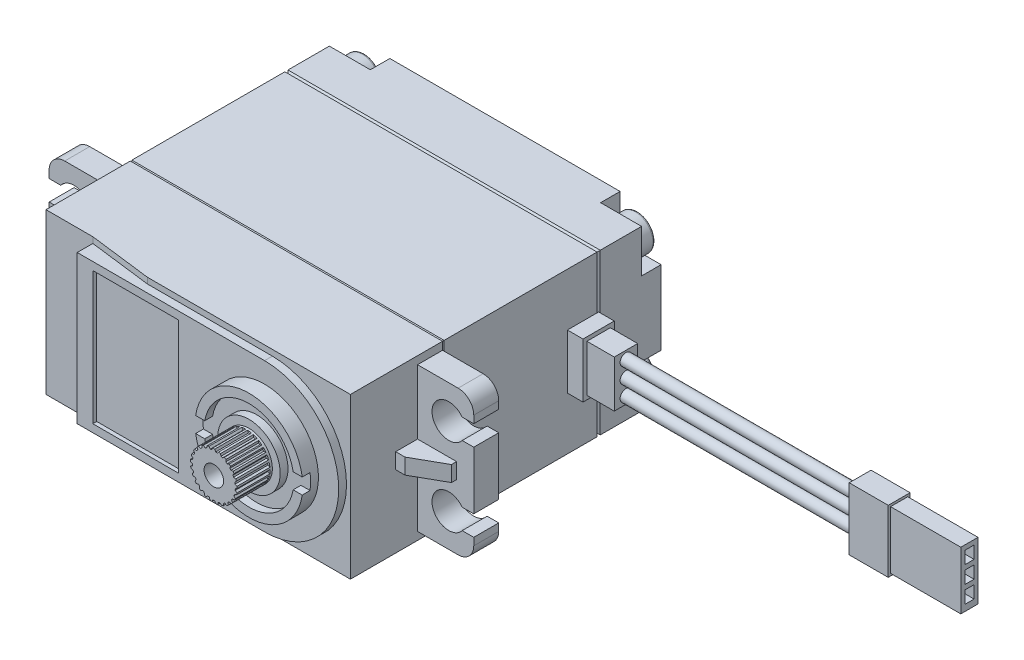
SolidWorks part; units mm, degrees
ref_plane "前视基准面" through (0, 0, 0) normal (0, 0, 1) x (1, 0, 0)
ref_plane "上视基准面" through (0, 0, 0) normal (0, 1, 0) x (1, 0, 0)
ref_plane "右视基准面" through (0, 0, 0) normal (1, 0, 0) x (0, 0, -1)
sketch "草图1" plane through (0, 0, 0) normal (0, 0, 1) x (1, 0, 0)
  line L1 (-20, 10.25) -> (20, 10.25)
  line L2 (-20, 10.25) -> (-20, -10.25)
  line L3 (-20, -10.25) -> (20, -10.25)
  line L4 (20, 10.25) -> (20, -10.25)
  dimension "D1" = 10.25
  dimension "D2" = 20.5
  dimension "D3" = 20
  dimension "D4" = 40
extrude "凸台-拉伸1" add sketch "草图1" along normal blind 8
chamfer "倒角1" distance 0.2 angle 45 4 edges at (0, 10.25, 8) (20, 0, 8) (0, -10.25, 8) (-20, 0, 8)
sketch "草图2" plane through (0, 0, 8) normal (0, 0, 1) x (1, 0, 0)
  line L0 (20, 10.25) -> (20, -10.25) construction
  line L1 (20, -10.25) -> (-20, -10.25) construction
  line L2 (-20, -10.25) -> (-20, 10.25) construction
  line L3 (-20, 10.25) -> (20, 10.25) construction
  line L4 (20, 10.25) -> (20, -10.25)
  line L5 (20, -10.25) -> (-20, -10.25)
  line L6 (-20, -10.25) -> (-20, 10.25)
  line L7 (-20, 10.25) -> (20, 10.25)
extrude "凸台-拉伸2" add sketch "草图2" along normal blind 20
chamfer "倒角4" distance 0.2 angle 45 4 edges at (-20, 0, 8) (0, 10.25, 8) (20, 0, 8) (0, -10.25, 8)
chamfer "倒角5" distance 0.2 angle 45 4 edges at (20, 0, 28) (0, -10.25, 28) (-20, 0, 28) (0, 10.25, 28)
sketch "草图3" plane through (0, 0, 28) normal (0, 0, 1) x (1, 0, 0)
  line L0 (20, 10.25) -> (20, -10.25) construction
  line L1 (20, -10.25) -> (-20, -10.25) construction
  line L2 (-20, -10.25) -> (-20, 10.25) construction
  line L3 (-20, 10.25) -> (20, 10.25) construction
  line L4 (20, 10.25) -> (20, -10.25)
  line L5 (20, -10.25) -> (-20, -10.25)
  line L6 (-20, -10.25) -> (-20, 10.25)
  line L7 (-20, 10.25) -> (20, 10.25)
extrude "凸台-拉伸3" add sketch "草图3" along normal blind 12.8
sketch "草图4" plane through (0, 0, 40.8) normal (0, 0, 1) x (1, 0, 0)
  line L0 (20, -10.25) -> (20, 10.25) construction
  circle A0 centre (10, 0) radius 6.9
  dimension "D1" = 10
  dimension "D2" = 13.8
extrude "凸台-拉伸4" add sketch "草图4" along normal blind 2
sketch "草图5" plane through (0, 0, 42.8) normal (0, 0, 1) x (1, 0, 0)
  circle A0 centre (10, 0) radius 3
  dimension "D1" = 6
extrude "凸台-拉伸5" add sketch "草图5" along normal blind 4.5
sketch "草图6" plane through (0, 0, 42.8) normal (0, 0, 1) x (1, 0, 0)
  circle A0 centre (10, 0) radius 4
  circle A1 centre (10, 0) radius 5.75
  dimension "D1" = 8
  dimension "D2" = 11.5
extrude "切除-拉伸1" cut sketch "草图6" against normal blind 1
sketch "草图7" plane through (0, 0, 41.8) normal (0, 0, 1) x (1, 0, 0)
  line L1 (3.1728, -1) -> (4.3376, -1)
  line L2 (3.1728, 1) -> (4.3376, 1)
  line L3 (15.6624, 1) -> (16.8272, 1)
  line L4 (15.6624, -1) -> (16.8272, -1)
  circle A0 centre (10, 0) radius 5.75 construction
  arc A1 (4.3376, 1) -> (4.3376, -1) centre (10, 0) ccw
  circle A2 centre (10, 0) radius 6.9 construction
  arc A3 (3.1728, 1) -> (3.1728, -1) centre (10, 0) ccw
  arc A4 (16.8272, -1) -> (16.8272, 1) centre (10, 0) ccw
  arc A5 (15.6624, -1) -> (15.6624, 1) centre (10, 0) ccw
  point P3 (0.7328, -1)
  point P4 (20.4054, -1)
  point P5 (0.7328, 1)
  point P6 (20.4054, 1)
extrude "切除-拉伸5" cut sketch "草图7" along normal blind 1
ref_plane "基准面1" through (0, 0, 28) normal (0, 0, 1) x (1, 0, 0)
sketch "草图8" plane through (0, 0, 28) normal (0, 0, 1) x (1, 0, 0)
  line L4 (-20, 10.25) -> (-20, -10.25) construction
  line L5 (-27.2, 9.25) -> (-27.2, 6.3)
  line L6 (20, -9.25) -> (27.2, -9.25)
  line L7 (-20, 9.25) -> (-20, -9.25)
  line L8 (-20, -9.25) -> (-27.2, -9.25)
  line L9 (-20, 9.25) -> (-27.2, 9.25)
  line L10 (27.2, -6.3) -> (27.2, -9.25)
  line L12 (25.7125, -6.3) -> (27.2, -6.3)
  line L13 (25.7125, -3.7) -> (27.2, -3.7)
  line L14 (-25.7125, 6.3) -> (-27.2, 6.3)
  line L15 (-25.7125, 3.7) -> (-27.2, 3.7)
  line L16 (-27.2, 3.7) -> (-27.2, -3.7)
  line L17 (27.2, 3.7) -> (27.2, -3.7)
  line L18 (-25.7125, -3.7) -> (-27.2, -3.7)
  line L19 (25.7125, 3.7) -> (27.2, 3.7)
  line L20 (-25.7125, -6.3) -> (-27.2, -6.3)
  line L21 (-27.2, -6.3) -> (-27.2, -9.25)
  line L22 (25.7125, 6.3) -> (27.2, 6.3)
  line L23 (27.2, 9.25) -> (27.2, 6.3)
  line L24 (20, 9.25) -> (20, -9.25)
  line L25 (20, 9.25) -> (27.2, 9.25)
  arc A0 (-25.7125, 3.7) -> (-25.7125, 6.3) centre (-24, 5) ccw
  arc A1 (-25.7125, -3.7) -> (-25.7125, -6.3) centre (-24, -5) cw
  arc A2 (25.7125, -3.7) -> (25.7125, -6.3) centre (24, -5) ccw
  arc A3 (25.7125, 3.7) -> (25.7125, 6.3) centre (24, 5) cw
  point P11 (-27.2, 10.25)
  point P12 (-27.2, -10.25)
  point P19 (-19.0859, 9.25)
  point P20 (-30.2671, 9.25)
  point P29 (-24, 6.3)
  point P31 (-29.7758, 6.3)
  point P32 (-24, 3.7)
  point P33 (-29.7758, 3.7)
  dimension "D5" = 4.3
extrude "凸台-拉伸6" add sketch "草图8" along normal blind 3.2
sketch "草图9" plane through (0, 0, 31.2) normal (0, 0, 1) x (1, 0, 0)
  line L5 (-25, -1) -> (-20, -1)
  line L6 (-25, 1) -> (-20, 1)
  line L7 (-20, -9.25) -> (-20, 9.25) construction
  line L8 (-20, -1) -> (-20, 1)
  line L10 (-25, -1) -> (-25, 1)
  line L12 (25, -1) -> (25, 1)
  line L13 (25, -1) -> (20, -1)
  line L14 (20, -1) -> (20, 1)
  line L15 (25, 1) -> (20, 1)
  line L18 (-20, -9.25) -> (-20, 9.25) construction
  line L19 (-25, -9.25) -> (-25, 9.25) construction
  point P0 (-27.2, 0)
  point P1 (-27.2, -1)
  point P2 (0.4483, -1)
  point P3 (0.4483, 0)
  point P6 (-27.2, 1)
  point P7 (0.4483, 1)
extrude "凸台-拉伸7" add sketch "草图9" along normal blind 2.8
sketch "草图10" plane through (0, -1, 0) normal (0, -1, 0) x (1, 0, 0)
  line L0 (-25, 31.8565) -> (-21.193, 34)
  line L1 (-25, 34) -> (-25, 31.2) construction
  line L2 (-25, 34) -> (-20, 34) construction
  line L3 (-21.193, 34) -> (-25, 34)
  line L4 (-25, 34) -> (-25, 31.8565)
  line L7 (25, 34) -> (25, 31.8565)
  line L8 (25, 31.8565) -> (21.193, 34)
  line L9 (21.193, 34) -> (25, 34)
extrude "切除-拉伸6" cut sketch "草图10" against normal blind 2.8
sketch "草图11" plane through (0, 0, 47.3) normal (0, 0, 1) x (1, 0, 0)
  circle A0 centre (10, 0) radius 1.25
  dimension "D1" = 2.5
extrude "切除-拉伸7" cut sketch "草图11" against normal blind 6
sketch "草图12" plane through (0, 0, 47.3) normal (0, 0, 1) x (1, 0, 0)
  line L1 (9.76, 2.7395) -> (9.88, 2.9976)
  line L2 (10.24, 2.7395) -> (10.12, 2.9976)
  line L3 (10.9137, 2.5938) -> (10.8617, 2.8736)
  line L4 (10.4488, 2.7131) -> (10.6292, 2.9333)
  line L5 (11.5301, 2.285) -> (11.5493, 2.569)
  line L6 (11.1095, 2.5163) -> (11.3389, 2.6846)
  line L7 (12.0503, 1.8327) -> (12.1395, 2.103)
  line L8 (11.7004, 2.1613) -> (11.9645, 2.2673)
  line L9 (12.4416, 1.2653) -> (12.5953, 1.5049)
  line L10 (12.1844, 1.6705) -> (12.4667, 1.7075)
  line L11 (12.6796, 0.6183) -> (12.888, 0.8122)
  line L12 (12.5313, 1.0748) -> (12.8138, 1.0404)
  line L13 (12.7492, -0.0675) -> (12.9992, 0.0685)
  line L14 (12.719, 0.4115) -> (12.9841, 0.308)
  line L15 (12.646, -0.7491) -> (12.922, -0.6796)
  line L16 (12.736, -0.2776) -> (12.967, -0.4438)
  line L17 (12.3766, -1.3836) -> (12.6612, -1.3849)
  line L18 (12.581, -0.9493) -> (12.7634, -1.1677)
  line L19 (11.9578, -1.9312) -> (12.2332, -2.0032)
  line L20 (12.2638, -1.5613) -> (12.3862, -1.8183)
  line L21 (11.4161, -2.3574) -> (11.6649, -2.4956)
  line L22 (11.8044, -2.0752) -> (11.859, -2.3546)
  line L23 (10.7853, -2.6355) -> (10.9919, -2.8313)
  line L24 (11.2316, -2.4588) -> (11.2151, -2.7429)
  line L25 (10.1052, -2.748) -> (10.2566, -2.989)
  line L26 (10.5815, -2.6878) -> (10.4948, -2.9589)
  line L27 (9.4185, -2.6878) -> (9.5052, -2.9589)
  line L28 (9.8948, -2.748) -> (9.7434, -2.989)
  line L29 (8.7684, -2.4588) -> (8.7849, -2.7429)
  line L30 (9.2147, -2.6355) -> (9.0081, -2.8313)
  line L31 (8.1956, -2.0752) -> (8.141, -2.3546)
  line L32 (8.5839, -2.3574) -> (8.3351, -2.4956)
  line L33 (7.7362, -1.5613) -> (7.6138, -1.8183)
  line L34 (8.0422, -1.9312) -> (7.7668, -2.0032)
  line L35 (7.419, -0.9493) -> (7.2366, -1.1677)
  line L36 (7.6234, -1.3836) -> (7.3388, -1.3849)
  line L37 (7.264, -0.2776) -> (7.033, -0.4438)
  line L38 (7.354, -0.7491) -> (7.078, -0.6796)
  line L39 (7.281, 0.4115) -> (7.0159, 0.308)
  line L40 (7.2508, -0.0675) -> (7.0008, 0.0685)
  line L41 (7.4687, 1.0748) -> (7.1862, 1.0404)
  line L42 (7.3204, 0.6183) -> (7.112, 0.8122)
  line L43 (7.8156, 1.6705) -> (7.5333, 1.7075)
  line L44 (7.5584, 1.2653) -> (7.4047, 1.5049)
  line L45 (8.2996, 2.1613) -> (8.0355, 2.2673)
  line L46 (7.9497, 1.8327) -> (7.8605, 2.103)
  line L47 (8.8905, 2.5163) -> (8.6611, 2.6846)
  line L48 (8.4699, 2.285) -> (8.4507, 2.569)
  line L49 (9.5512, 2.7131) -> (9.3708, 2.9333)
  line L50 (9.0863, 2.5938) -> (9.1383, 2.8736)
  arc A0 (9.76, 2.7395) -> (9.5512, 2.7131) centre (10, 0) ccw
  arc A1 (9.0863, 2.5938) -> (8.8905, 2.5163) centre (10, 0) ccw
  circle A2 centre (10, 0) radius 3 construction
  arc A3 (9.88, 2.9976) -> (9.3708, 2.9333) centre (10, 0) ccw
  arc A4 (9.1383, 2.8736) -> (8.6611, 2.6846) centre (10, 0) ccw
  arc A5 (8.4699, 2.285) -> (8.2996, 2.1613) centre (10, 0) ccw
  arc A6 (8.4507, 2.569) -> (8.0355, 2.2673) centre (10, 0) ccw
  arc A7 (7.9497, 1.8327) -> (7.8156, 1.6705) centre (10, 0) ccw
  arc A8 (7.8605, 2.103) -> (7.5333, 1.7075) centre (10, 0) ccw
  arc A9 (7.5584, 1.2653) -> (7.4687, 1.0748) centre (10, 0) ccw
  arc A10 (7.4047, 1.5049) -> (7.1862, 1.0404) centre (10, 0) ccw
  arc A11 (7.3204, 0.6183) -> (7.281, 0.4115) centre (10, 0) ccw
  arc A12 (7.112, 0.8122) -> (7.0159, 0.308) centre (10, 0) ccw
  arc A13 (7.2508, -0.0675) -> (7.264, -0.2776) centre (10, 0) ccw
  arc A14 (7.0008, 0.0685) -> (7.033, -0.4438) centre (10, 0) ccw
  arc A15 (7.354, -0.7491) -> (7.419, -0.9493) centre (10, 0) ccw
  arc A16 (7.078, -0.6796) -> (7.2366, -1.1677) centre (10, 0) ccw
  arc A17 (7.3388, -1.3849) -> (7.6138, -1.8183) centre (10, 0) ccw
  arc A18 (7.6234, -1.3836) -> (7.7362, -1.5613) centre (10, 0) ccw
  arc A19 (8.0422, -1.9312) -> (8.1956, -2.0752) centre (10, 0) ccw
  arc A20 (7.7668, -2.0032) -> (8.141, -2.3546) centre (10, 0) ccw
  arc A21 (8.5839, -2.3574) -> (8.7684, -2.4588) centre (10, 0) ccw
  arc A22 (8.3351, -2.4956) -> (8.7849, -2.7429) centre (10, 0) ccw
  arc A23 (9.2147, -2.6355) -> (9.4185, -2.6878) centre (10, 0) ccw
  arc A24 (9.0081, -2.8313) -> (9.5052, -2.9589) centre (10, 0) ccw
  arc A25 (9.8948, -2.748) -> (10.1052, -2.748) centre (10, 0) ccw
  arc A26 (9.7434, -2.989) -> (10.2566, -2.989) centre (10, 0) ccw
  arc A27 (10.5815, -2.6878) -> (10.7853, -2.6355) centre (10, 0) ccw
  arc A28 (10.4948, -2.9589) -> (10.9919, -2.8313) centre (10, 0) ccw
  arc A29 (11.2316, -2.4588) -> (11.4161, -2.3574) centre (10, 0) ccw
  arc A30 (11.2151, -2.7429) -> (11.6649, -2.4956) centre (10, 0) ccw
  arc A31 (11.8044, -2.0752) -> (11.9578, -1.9312) centre (10, 0) ccw
  arc A32 (11.859, -2.3546) -> (12.2332, -2.0032) centre (10, 0) ccw
  arc A33 (12.3862, -1.8183) -> (12.6612, -1.3849) centre (10, 0) ccw
  arc A34 (12.2638, -1.5613) -> (12.3766, -1.3836) centre (10, 0) ccw
  arc A35 (12.7634, -1.1677) -> (12.922, -0.6796) centre (10, 0) ccw
  arc A36 (12.581, -0.9493) -> (12.646, -0.7491) centre (10, 0) ccw
  arc A37 (12.967, -0.4438) -> (12.9992, 0.0685) centre (10, 0) ccw
  arc A38 (12.736, -0.2776) -> (12.7492, -0.0675) centre (10, 0) ccw
  arc A39 (12.9841, 0.308) -> (12.888, 0.8122) centre (10, 0) ccw
  arc A40 (12.719, 0.4115) -> (12.6796, 0.6183) centre (10, 0) ccw
  arc A41 (12.5313, 1.0748) -> (12.4416, 1.2653) centre (10, 0) ccw
  arc A42 (12.8138, 1.0404) -> (12.5953, 1.5049) centre (10, 0) ccw
  arc A43 (12.1844, 1.6705) -> (12.0503, 1.8327) centre (10, 0) ccw
  arc A44 (12.4667, 1.7075) -> (12.1395, 2.103) centre (10, 0) ccw
  arc A45 (11.7004, 2.1613) -> (11.5301, 2.285) centre (10, 0) ccw
  arc A46 (11.9645, 2.2673) -> (11.5493, 2.569) centre (10, 0) ccw
  arc A47 (11.1095, 2.5163) -> (10.9137, 2.5938) centre (10, 0) ccw
  arc A48 (11.3389, 2.6846) -> (10.8617, 2.8736) centre (10, 0) ccw
  arc A49 (10.4488, 2.7131) -> (10.24, 2.7395) centre (10, 0) ccw
  arc A50 (10.6292, 2.9333) -> (10.12, 2.9976) centre (10, 0) ccw
  point P111 (10, 0)
  dimension "D1" = 5.5
  dimension "D4" = 25
extrude "切除-拉伸8" cut sketch "草图12" against normal blind 4.2
sketch "草图13" plane through (0, 0, 40.8) normal (0, 0, 1) x (1, 0, 0)
  line L0 (10, 9.5) -> (-14, 9.5)
  line L1 (10, -9.5) -> (-14, -9.5)
  line L2 (20, -10.25) -> (20, 10.25) construction
  line L5 (-20, -10.25) -> (20, -10.25) construction
  line L6 (-14, 9.5) -> (-14, -9.5)
  line L7 (-20, 10.25) -> (-20, -10.25) construction
  line L8 (20, 10.25) -> (-20, 10.25) construction
  line L9 (20, -10.25) -> (20, 10.25)
  line L10 (-20, -10.25) -> (20, -10.25)
  line L11 (-20, 10.25) -> (-20, -10.25)
  line L12 (20, 10.25) -> (-20, 10.25)
  arc A0 (10, -9.5) -> (10, 9.5) centre (10, 0) ccw
  point P15 (-14, 10.25)
  point P16 (-14, -11.4768)
  dimension "D1" = 19
extrude "切除-拉伸9" cut sketch "草图13" against normal blind 1
sketch "草图14" plane through (0, -10.25, 0) normal (0, -1, 0) x (1, 0, 0)
  line L1 (-20, 39.8) -> (20, 39.8) construction
  line L2 (-14, 39.8) -> (10, 39.8) construction
  line L3 (-20, 38.8) -> (-14, 38.8)
  line L4 (-14, 38.8) -> (-6, 39.8)
  line L5 (-14, 39.8) -> (-6, 39.8)
  line L6 (-14, 39.8) -> (-20, 39.8)
  line L7 (-20, 39.8) -> (-20, 38.8)
  dimension "D1" = 8
extrude "切除-拉伸10" cut sketch "草图14" against normal blind 0.75
mirror "镜向1" about plane through (0, 0, 0) normal (0, 1, 0) of "切除-拉伸10"
sketch "草图15" plane through (0, 0, 39.8) normal (0, 0, 1) x (1, 0, 0)
  line L1 (-20, 9.5) -> (-14, 9.5)
  line L2 (-20, 9.5) -> (-20, -9.5)
  line L3 (-20, -9.5) -> (-14, -9.5)
  line L4 (-14, 9.5) -> (-14, -9.5)
extrude "切除-拉伸11" cut sketch "草图15" against normal blind 1
sketch "草图16" plane through (0, 0, 40.8) normal (0, 0, 1) x (1, 0, 0)
  line L4 (-12, 9.5) -> (-12, -9.5)
  line L5 (-12, 8.5) -> (-12, -8.5)
  line L6 (-1, 9.5) -> (-1, -9.5) construction
  line L7 (10, 8.5) -> (-14, 8.5)
  line L8 (-1, 8.5) -> (-12, 8.5)
  line L9 (-12, 9.5) -> (-12, -9.5) construction
  line L13 (-12, -8.5) -> (-1, -8.5)
  line L14 (-1, 8.5) -> (-1, -8.5)
  dimension "D2" = 2
  dimension "D3" = 1
  dimension "D7" = 11
extrude "切除-拉伸12" cut sketch "草图16" against normal blind 0.5
fillet "圆角1" radius 2 4 edges at (27.2, 9.25, 29.6) (27.2, -9.25, 29.6) (-27.2, 9.25, 29.6) (-27.2, -9.25, 29.6)
sketch "草图17" plane through (20, 0, 0) normal (1, 0, 0) x (0, 0, -1)
  line L2 (-12, 3.5) -> (-8, 3.5)
  line L3 (-12, 3.5) -> (-12, -3.5)
  line L4 (-12, -3.5) -> (-8, -3.5)
  line L5 (-8, 3.5) -> (-8, -3.5)
  dimension "D2" = 7
  dimension "D3" = 3.5
  dimension "D4" = 4
extrude "凸台-拉伸8" add sketch "草图17" along normal blind 2
sketch "草图18" plane through (22, 0, 0) normal (1, 0, 0) x (0, 0, -1)
  line L8 (-11.5, 3) -> (-11.5, -3)
  line L9 (-11.5, -3) -> (-8.5, -3)
  line L10 (-8.5, -3) -> (-8.5, 3)
  line L11 (-8.5, 3) -> (-11.5, 3)
  line L12 (-11.5, 3) -> (-11.5, -3)
  line L13 (-11.5, -3) -> (-8.5, -3)
  line L14 (-8.5, -3) -> (-8.5, 3)
  line L15 (-8.5, 3) -> (-11.5, 3)
  dimension "D1" = 0.5
extrude "凸台-拉伸9" add sketch "草图18" along normal blind 3.5
sketch "草图19" plane through (25.5, 0, 0) normal (1, 0, 0) x (0, 0, -1)
  line L0 (-8.5, -3) -> (-8.5, 3) construction
  line L1 (-8.5, -3) -> (-8.5, 3) construction
  line L2 (-8.5, 3) -> (-11.5, 3) construction
  circle A0 centre (-10, 0) radius 0.75
  circle A1 centre (-10, 2) radius 0.75
  circle A2 centre (-10, -2) radius 0.75
  dimension "D1" = 1.5
  dimension "D2" = 1.5
  dimension "D3" = 1.5
  dimension "D4" = 1.5
  dimension "D5" = 1.5
  dimension "D6" = 1.5
  dimension "D7" = 1
  dimension "D8" = 2
  dimension "D9" = 2
extrude "凸台-拉伸10" add sketch "草图19" along normal blind 30
sketch "草图20" plane through (55.5, 0, 0) normal (1, 0, 0) x (0, 0, -1)
  line L1 (-11.4, 4) -> (-8.6, 4)
  line L2 (-11.4, 4) -> (-11.4, -4)
  line L3 (-11.4, -4) -> (-8.6, -4)
  line L4 (-8.6, 4) -> (-8.6, -4)
  circle A0 centre (-10, 2) radius 0.75 construction
  dimension "D1" = 8
  dimension "D2" = 2.8
  dimension "D3" = 1.4
  dimension "D4" = 4
extrude "凸台-拉伸11" add sketch "草图20" along normal blind 5
sketch "草图21" plane through (60.5, 0, 0) normal (1, 0, 0) x (0, 0, -1)
  line L5 (-10.59, 3.1) -> (-9.4, 3.1)
  line L6 (-10.59, 3.1) -> (-10.59, 1.5)
  line L7 (-10.59, 1.5) -> (-9.4, 1.5)
  line L8 (-11.1, 3.7) -> (-11.1, -3.7)
  line L9 (-11.1, -3.7) -> (-8.9, -3.7)
  line L10 (-8.9, -3.7) -> (-8.9, 3.7)
  line L11 (-8.9, 3.7) -> (-11.1, 3.7)
  line L12 (-11.1, 3.7) -> (-11.1, -3.7)
  line L13 (-11.1, -3.7) -> (-8.9, -3.7)
  line L14 (-8.9, -3.7) -> (-8.9, 3.7)
  line L15 (-8.9, 3.7) -> (-11.1, 3.7)
  line L16 (-9.4, 3.1) -> (-9.4, 1.5)
  line L17 (-10.59, 0.9) -> (-9.4, 0.9)
  line L18 (-10.59, 0.9) -> (-10.59, -0.7)
  line L19 (-10.59, -0.7) -> (-9.4, -0.7)
  line L20 (-9.4, 0.9) -> (-9.4, -0.7)
  line L21 (-10.59, -1.3) -> (-9.4, -1.3)
  line L22 (-10.59, -1.3) -> (-10.59, -2.9)
  line L23 (-10.59, -2.9) -> (-9.4, -2.9)
  line L24 (-9.4, -1.3) -> (-9.4, -2.9)
  dimension "D2" = 1.6
  dimension "D3" = 1.6
  dimension "D4" = 1.6
  dimension "D5" = 0.5
  dimension "D6" = 0.5
  dimension "D7" = 0.5
  dimension "D8" = 0.6
  dimension "D9" = 0.6
  dimension "D10" = 0.6
  dimension "D1" = 0.3
extrude "凸台-拉伸12" add sketch "草图21" along normal blind 9
sketch "草图22" plane through (0, 0, 0) normal (0, 0, -1) x (-1, 0, 0)
  line L5 (-20, 4.75) -> (-20, 10.25)
  line L6 (-20, 10.25) -> (-14.75, 10.25)
  line L7 (-17.5, -4.75) -> (-20, -4.75)
  line L8 (-14.75, -7.5) -> (-14.75, -10.25)
  line L9 (-20, -4.75) -> (-20, -10.25)
  line L11 (-20, -10.25) -> (-14.75, -10.25)
  line L12 (-14.75, 7.5) -> (-14.75, 10.25)
  line L13 (-17.5, 4.75) -> (-20, 4.75)
  line L14 (14.75, -7.5) -> (14.75, -10.25)
  line L15 (20, -10.25) -> (14.75, -10.25)
  line L16 (20, -4.75) -> (20, -10.25)
  line L17 (17.5, -4.75) -> (20, -4.75)
  line L18 (20, 4.75) -> (20, 10.25)
  line L19 (17.5, 4.75) -> (20, 4.75)
  line L20 (14.75, 7.5) -> (14.75, 10.25)
  line L21 (20, 10.25) -> (14.75, 10.25)
  arc A0 (-14.75, -7.5) -> (-17.5, -4.75) centre (-17.5, -7.5) ccw
  arc A1 (-14.75, 7.5) -> (-17.5, 4.75) centre (-17.5, 7.5) cw
  arc A2 (14.75, -7.5) -> (17.5, -4.75) centre (17.5, -7.5) cw
  arc A3 (14.75, 7.5) -> (17.5, 4.75) centre (17.5, 7.5) ccw
  dimension "D3" = 5.5
extrude "切除-拉伸13" cut sketch "草图22" against normal blind 2.5
sketch "草图23" plane through (0, 0, 2.5) normal (0, 0, -1) x (-1, 0, 0)
  line L4 (-17.25, -7.75) -> (-15.6165, -7.75)
  line L5 (-17.25, -7.25) -> (-15.6165, -7.25)
  line L6 (-17.25, 7.25) -> (-17.25, 5.6165)
  line L7 (-17.25, 7.75) -> (-15.6165, 7.75)
  line L8 (-17.25, -7.25) -> (-17.25, -5.6165)
  line L9 (-17.75, 7.25) -> (-17.75, 5.6165)
  line L10 (-17.75, -7.25) -> (-17.75, -5.6165)
  line L11 (-17.25, 7.25) -> (-15.6165, 7.25)
  line L12 (-19.3835, -7.25) -> (-17.75, -7.25)
  line L13 (-19.3835, -7.75) -> (-17.75, -7.75)
  line L14 (-17.75, -9.3835) -> (-17.75, -7.75)
  line L15 (-17.25, -9.3835) -> (-17.25, -7.75)
  line L16 (-19.3835, 7.25) -> (-17.75, 7.25)
  line L17 (-19.3835, 7.75) -> (-17.75, 7.75)
  line L18 (-17.25, 9.3835) -> (-17.25, 7.75)
  line L19 (-17.75, 9.3835) -> (-17.75, 7.75)
  line L20 (17.25, -7.25) -> (15.6165, -7.25)
  line L21 (17.25, -7.75) -> (15.6165, -7.75)
  line L22 (17.25, -9.3835) -> (17.25, -7.75)
  line L23 (17.75, -9.3835) -> (17.75, -7.75)
  line L24 (19.3835, -7.75) -> (17.75, -7.75)
  line L25 (19.3835, -7.25) -> (17.75, -7.25)
  line L26 (17.75, -7.25) -> (17.75, -5.6165)
  line L27 (17.25, -7.25) -> (17.25, -5.6165)
  line L28 (19.3835, 7.25) -> (17.75, 7.25)
  line L29 (17.75, 7.25) -> (17.75, 5.6165)
  line L30 (17.25, 7.25) -> (17.25, 5.6165)
  line L31 (17.25, 7.25) -> (15.6165, 7.25)
  line L32 (17.25, 7.75) -> (15.6165, 7.75)
  line L33 (17.25, 9.3835) -> (17.25, 7.75)
  line L34 (17.75, 9.3835) -> (17.75, 7.75)
  line L35 (19.3835, 7.75) -> (17.75, 7.75)
  circle A0 centre (-17.5, 7.5) radius 2.25
  arc A1 (-15.6165, 7.25) -> (-15.6165, 7.75) centre (-17.5, 7.5) ccw
  arc A2 (-17.75, 5.6165) -> (-17.25, 5.6165) centre (-17.5, 7.5) ccw
  arc A3 (-19.3835, 7.75) -> (-19.3835, 7.25) centre (-17.5, 7.5) ccw
  arc A4 (-17.25, 9.3835) -> (-17.75, 9.3835) centre (-17.5, 7.5) ccw
  arc A5 (-17.75, -5.6165) -> (-17.25, -5.6165) centre (-17.5, -7.5) cw
  arc A6 (-15.6165, -7.25) -> (-15.6165, -7.75) centre (-17.5, -7.5) cw
  arc A7 (-19.3835, -7.75) -> (-19.3835, -7.25) centre (-17.5, -7.5) cw
  arc A8 (-17.25, -9.3835) -> (-17.75, -9.3835) centre (-17.5, -7.5) cw
  circle A9 centre (-17.5, -7.5) radius 2.25
  arc A10 (15.6165, -7.25) -> (15.6165, -7.75) centre (17.5, -7.5) ccw
  arc A11 (17.25, -9.3835) -> (17.75, -9.3835) centre (17.5, -7.5) ccw
  arc A12 (19.3835, -7.75) -> (19.3835, -7.25) centre (17.5, -7.5) ccw
  arc A13 (17.75, -5.6165) -> (17.25, -5.6165) centre (17.5, -7.5) ccw
  circle A14 centre (17.5, -7.5) radius 2.25
  arc A15 (17.75, 5.6165) -> (17.25, 5.6165) centre (17.5, 7.5) cw
  arc A16 (19.3835, 7.75) -> (19.3835, 7.25) centre (17.5, 7.5) cw
  arc A17 (15.6165, 7.25) -> (15.6165, 7.75) centre (17.5, 7.5) cw
  arc A18 (17.25, 9.3835) -> (17.75, 9.3835) centre (17.5, 7.5) cw
  circle A19 centre (17.5, 7.5) radius 2.25
  point P8 (-19.75, 7.25)
  point P9 (-13.9428, 7.25)
  point P10 (-17.75, 9.75)
  point P11 (-17.75, 5.25)
  point P12 (-19.75, 7.75)
  point P13 (-13.9428, 7.75)
  point P14 (-17.25, 9.75)
  point P15 (-17.25, 5.25)
  dimension "D1" = 4.5
  dimension "D2" = 3.8
extrude "凸台-拉伸13" add sketch "草图23" along normal blind 2
fillet "圆角2" radius 0.3 4 edges at (-19.75, -7.5, 0.5) (19.75, -7.5, 0.5) (15.25, 7.5, 0.5) (-15.25, 7.5, 0.5)
